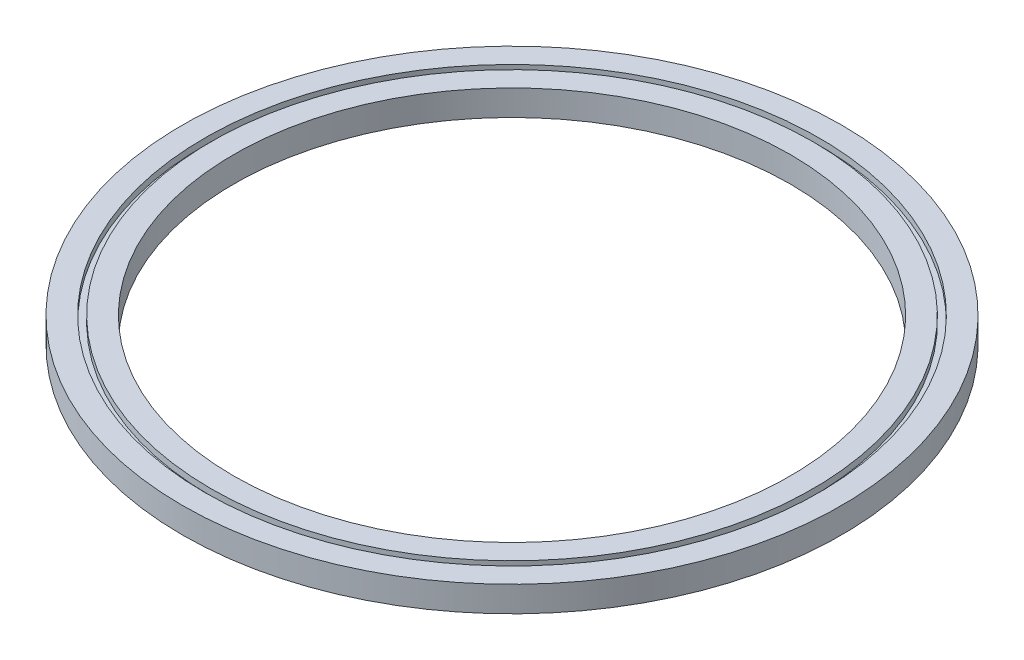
SolidWorks part; units mm, degrees
ref_plane "Face" through (0, 0, 0) normal (0, 0, 1) x (1, 0, 0)
ref_plane "Dessus" through (0, 0, 0) normal (0, 1, 0) x (1, 0, 0)
ref_plane "Droite" through (0, 0, 0) normal (1, 0, 0) x (0, 0, -1)
sketch "Esquisse1" plane through (0, 0, 0) normal (0, 0, 1) x (1, 0, 0)
  line L0 (0, 0) -> (0, -55.4338) construction
  line L1 (21.75, 0) -> (21.75, -2)
  line L2 (21.75, -2) -> (25.75, -2)
  line L3 (25.75, -2) -> (25.75, 0)
  line L4 (25.75, 0) -> (24, 0)
  line L5 (24, 0) -> (24, -0.5)
  line L6 (24, -0.5) -> (23.5, -0.5)
  line L7 (23.5, -0.5) -> (23.5, 0)
  line L8 (23.5, 0) -> (21.75, 0)
  dimension "D1" = 21.75
  dimension "D2" = 0.5
  dimension "D3" = 0.5
  dimension "D4" = 25.75
  dimension "D5" = 2
  dimension "D6" = 23.5
revolve "Révolution1" add sketch "Esquisse1" angle 360 about L0
